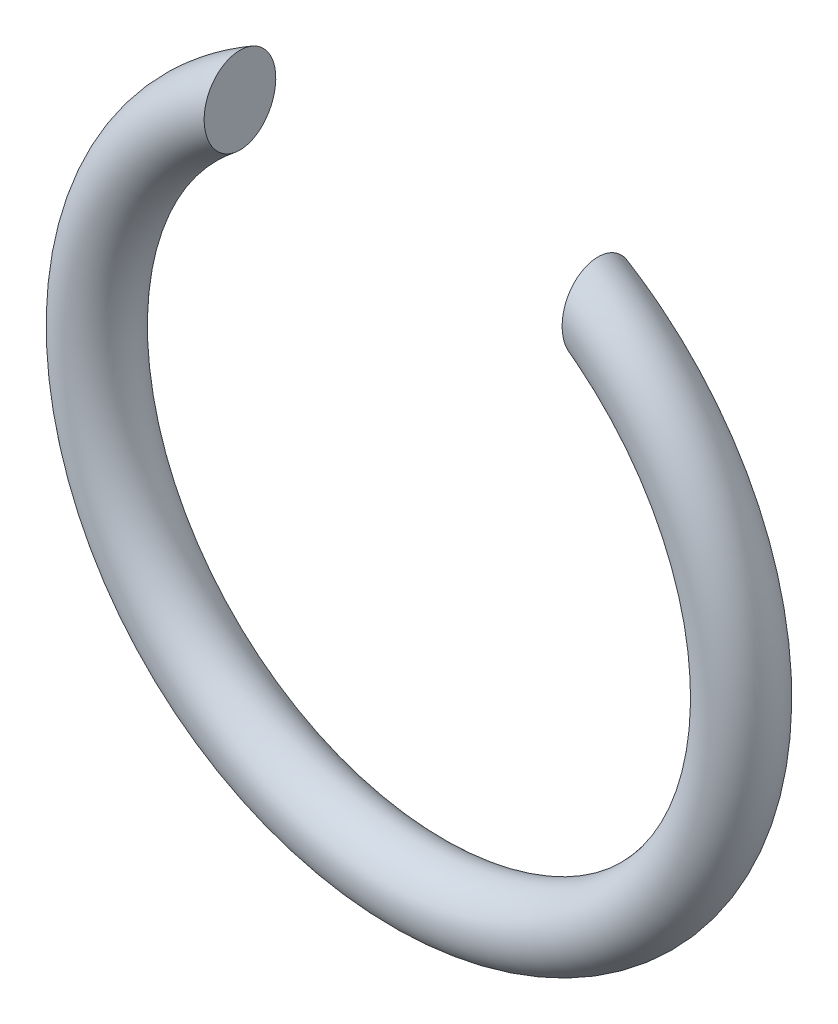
SolidWorks part; units mm, degrees
ref_plane "Front" through (0, 0, 0) normal (0, 0, 1) x (1, 0, 0)
ref_plane "Top" through (0, 0, 0) normal (0, 1, 0) x (1, 0, 0)
ref_plane "Right" through (0, 0, 0) normal (1, 0, 0) x (0, 0, -1)
sketch "Sketch1" plane through (0, 0, 0) normal (0, 0, 1) x (1, 0, 0)
  circle A1 centre (0, 0) radius 3.6
  dimension "D1" = 7.2
sketch "Sketch2" plane through (0, 0, 0) normal (0, 1, 0) x (1, 0, 0)
  circle A0 centre (3.6, 0) radius 0.4
  dimension "d1" = 0.8
sweep "Base-Sweep" add profiles "Sketch2" path "Sketch1"
sketch "Sketch3" plane through (0, 0, 0) normal (0, 0, 1) x (1, 0, 0)
  line L1 (-2, 0) -> (2, 0)
  line L2 (-2, 0) -> (-2, 4)
  line L3 (-2, 4) -> (2, 4)
  line L4 (2, 0) -> (2, 4)
  dimension "B" = 4
  dimension "B/2" = 2
  dimension "D3" = 4
extrude "Cut-Extrude1" cut sketch "Sketch3" against normal through all and the other way through all
equation "\"B/2@Sketch3\" = \"B@Sketch3\" / 2"
